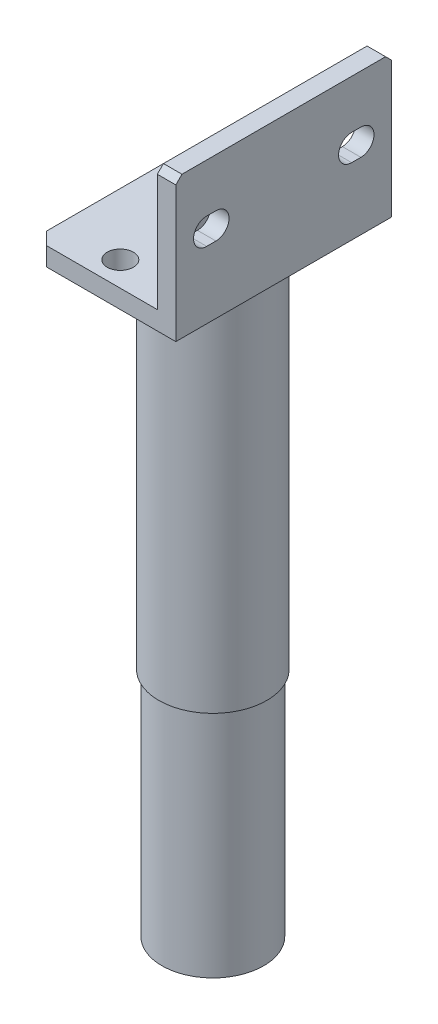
SolidWorks part; units mm, degrees
ref_plane "前基準面" through (0, 0, 0) normal (0, 0, 1) x (1, 0, 0)
ref_plane "上基準面" through (0, 0, 0) normal (0, 1, 0) x (1, 0, 0)
ref_plane "右基準面" through (0, 0, 0) normal (1, 0, 0) x (0, 0, -1)
sketch "草圖1" plane through (0, 0, 0) normal (0, 0, 1) x (1, 0, 0)
  line L1 (0, 0) -> (46, 0)
  line L2 (0, 0) -> (0, 6)
  line L3 (40, 46) -> (46, 46)
  line L4 (46, 0) -> (46, 46)
  line L6 (40, 46) -> (40, 6)
  line L7 (40, 6) -> (0, 6)
  dimension "D1" = 6
  dimension "D2" = 6
  dimension "D3" = 40
  dimension "D4" = 40
extrude "填料-伸長1" add sketch "草圖1" along normal blind 70
sketch "草圖5" plane through (0, 6, 0) normal (0, 1, 0) x (-1, 0, 0)
  line L0 (-20, 0) -> (-20, 8) construction
  line L1 (-40, 0) -> (0, 0) construction
  circle A0 centre (-20, 8) radius 4.25
  dimension "D1" = 8.5
  dimension "D2" = 8
extrude "除料-伸長2" cut sketch "草圖5" against normal blind 400
chamfer "導角1" distance 4 angle 45 2 edges at (0, 3, 70) (0, 3, 0)
sketch "草圖3" plane through (40, 0, 0) normal (-1, 0, 0) x (0, 0, 1)
  line L0 (10, 26) -> (13, 26) construction
  line L1 (10, 30.25) -> (13, 30.25)
  line L2 (10, 21.75) -> (13, 21.75)
  line L3 (23.5439, 26) -> (70, 26) construction
  line L4 (70, 46) -> (70, 6) construction
  line L5 (0, 46) -> (0, 6) construction
  arc A0 (10, 30.25) -> (10, 21.75) centre (10, 26) ccw
  arc A1 (13, 21.75) -> (13, 30.25) centre (13, 26) ccw
  point P2 (11.5, 26)
  dimension "D3" = 10
  dimension "D1" = 8.5
  dimension "D2" = 3
extrude "除料-伸長1" cut sketch "草圖3" against normal through all
ref_plane "平面1" through (0, 0, 35) normal (0, 0, 1) x (1, 0, 0)
mirror "鏡射1" about plane through (0, 0, 35) normal (0, 0, 1) of "除料-伸長1"
mirror "鏡射2" about plane through (0, 0, 35) normal (0, 0, 1) of "除料-伸長2"
chamfer "導角2" distance 2 angle 45 2 edges at (43, 46, 70) (43, 46, 0)
sketch "草圖4" plane through (0, 0, 0) normal (0, -1, 0) x (1, 0, 0)
  line L0 (0, 35) -> (46, 35) construction
  line L1 (0, 66) -> (0, 4) construction
  line L2 (46, 70) -> (46, 0) construction
  circle A0 centre (23, 35) radius 17.5
  circle A1 centre (23, 35) radius 10
  dimension "D1" = 35
  dimension "D2" = 20
extrude "填料-伸長2" add sketch "草圖4" along normal blind 196
sketch "草圖6" plane through (0, 0, 0) normal (0, -1, 0) x (1, 0, 0)
  circle A0 centre (23, 35) radius 10
extrude "除料-伸長3" cut sketch "草圖6" against normal through all
sketch "草圖8" plane through (0, 0, 35) normal (0, 0, 1) x (1, 0, 0)
  line L0 (23, -196) -> (23, -313.6899) construction
  line L1 (40.5, -196) -> (39.5, -196)
  line L2 (40.5, -196) -> (40.5, -121)
  line L3 (40.5, -121) -> (39.5, -121)
  line L4 (39.5, -196) -> (39.5, -121)
  line L5 (5.5, -196) -> (40.5, -196) construction
  dimension "D1" = 75
  dimension "D2" = 1
revolve "除料-旋轉2" cut sketch "草圖8" angle 360 about L0
